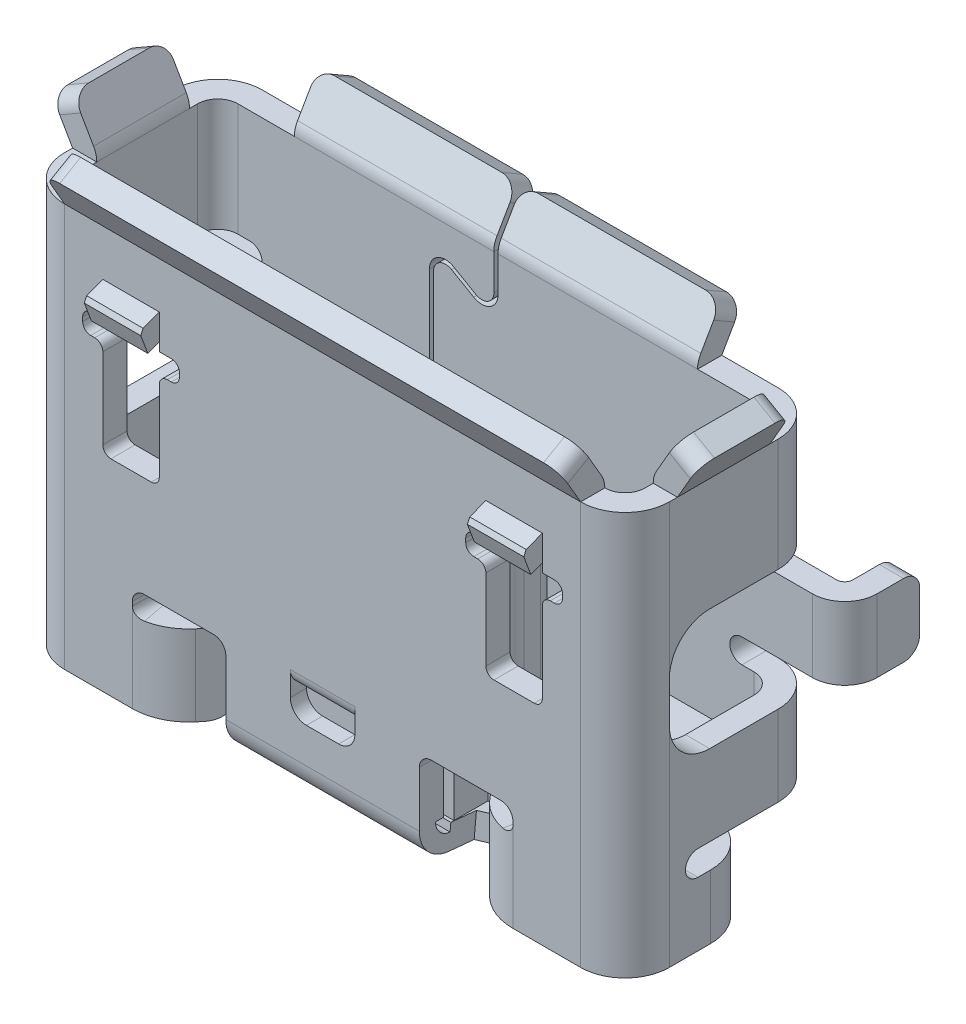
SolidWorks part; units mm, degrees
ref_plane "Front Plane" through (0, 0, 0) normal (0, 0, 1) x (1, 0, 0)
ref_plane "Top Plane" through (0, 0, 0) normal (0, 1, 0) x (1, 0, 0)
ref_plane "Right Plane" through (0, 0, 0) normal (1, 0, 0) x (0, 0, -1)
imported_body "Imported1"
move or copy body "Body-Move/Copy1" bodies to move or copy 101 copy no rotation origin (0, 1.1136, -1.2023) rotation axis (-1, 0, 0) rotation angle 90
move or copy body "Body-Move/Copy2" bodies to move or copy 102 copy no rotation origin (-1.3, 1.1136, 0) rotation axis (0, 0, 1) rotation angle 180
